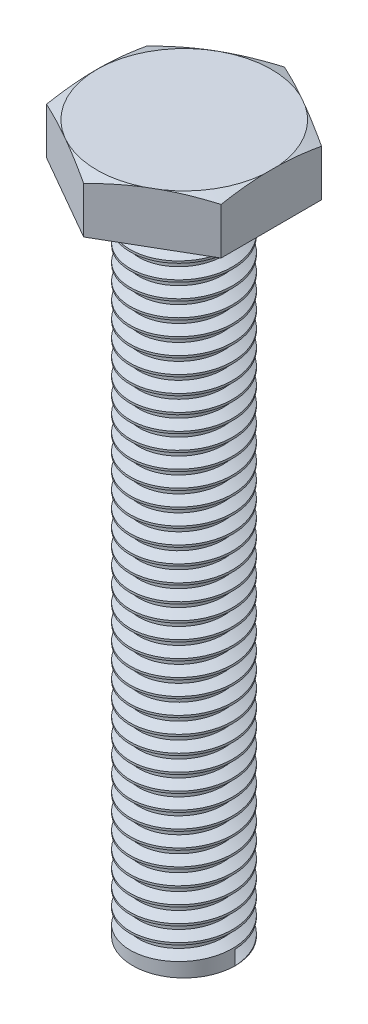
SolidWorks part; units mm, degrees
ref_plane "Front Plane" through (0, 0, 0) normal (0, 0, 1) x (1, 0, 0)
ref_plane "Top Plane" through (0, 0, 0) normal (0, 1, 0) x (1, 0, 0)
ref_plane "Right Plane" through (0, 0, 0) normal (1, 0, 0) x (0, 0, -1)
sketch "Sketch1" plane through (0, 0, 0) normal (0, 1, 0) x (1, 0, 0)
  circle A0 centre (0, 0) radius 7.9375
  dimension "D1" = 15.875
extrude "Boss-Extrude1" add sketch "Sketch1" along normal blind 101.6
sketch "Sketch2" plane through (0, 101.6, 0) normal (0, 1, 0) x (1, 0, 0)
  line L1 (13.5119, -7.7592) -> (13.4756, 7.822)
  line L2 (13.4756, 7.822) -> (-0.0363, 15.5812)
  line L3 (-0.0363, 15.5812) -> (-13.5119, 7.7592)
  line L4 (-13.5119, 7.7592) -> (-13.4756, -7.822)
  line L5 (-13.4756, -7.822) -> (0.0363, -15.5812)
  line L6 (0.0363, -15.5812) -> (13.5119, -7.7592)
  circle A0 centre (0, 0) radius 13.4938 construction
extrude "Boss-Extrude2" add sketch "Sketch2" along normal blind 7.9375
sketch "Sketch4" plane through (0, 0, 0) normal (0, 0, 1) x (1, 0, 0)
  line L0 (-13.4756, 109.5375) -> (-20.8739, 109.5375)
  line L1 (-20.8739, 109.5375) -> (-20.8739, 106.8447)
  line L2 (-20.8739, 106.8447) -> (-13.4756, 109.5375)
  line L3 (0.0363, 109.5375) -> (0.0363, 85.6753) construction
  dimension "D1" = 20
revolve "Cut-Revolve1" cut sketch "Sketch4" angle 360 about L3
thread "Thread1" pitch 2.54 start angle 0, offset 0, length 101.6, pitch 2.54, diameter 15.875
ref_plane "Plane1" through (7.9375, 0, 0) normal (0, 0, 1) x (1, 0, 0)
sketch "Thread Profile1" plane through (7.9375, 0, 0) normal (0, 0, 1) x (1, 0, 0)
  line L0 (0, 0) -> (0, 2.54) construction
  line L11 (0, 0) -> (0, 2.2225)
  line L12 (0, 2.2225) -> (-1.3748, 1.4287)
  line L13 (-1.3748, 1.4287) -> (-1.3748, 0.7937)
  line L15 (-1.3748, 0.7937) -> (0, 0)
  line L17 (-1.3748, 1.1112) -> (0, 1.1112) construction
  point P2 (0, 0)
  dimension "Pitch" = 2.54
  dimension "Profile_Angle" = 60
  dimension "Profile_Land" = 0.635
  dimension "Profile_Height" = 1.3748
